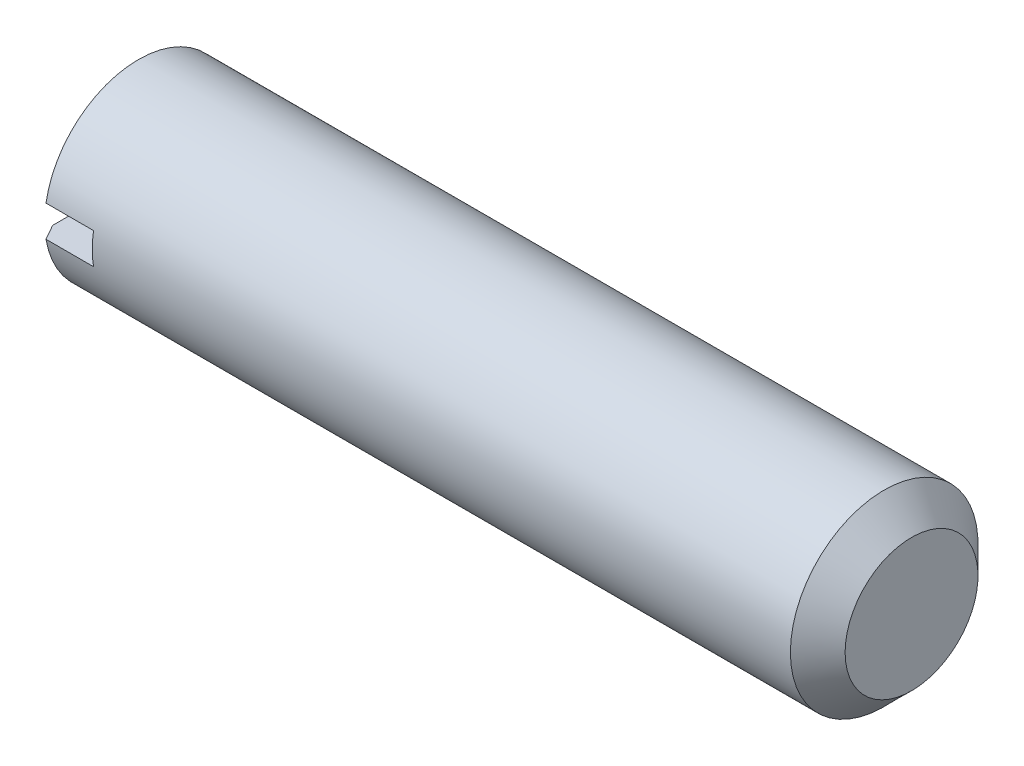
SolidWorks part; units mm, degrees
ref_plane "Plane1" through (0, 0, 0) normal (0, 0, 1) x (1, 0, 0)
ref_plane "Plane2" through (0, 0, 0) normal (0, 1, 0) x (1, 0, 0)
ref_plane "Plane3" through (0, 0, 0) normal (1, 0, 0) x (0, 0, -1)
sketch "BodySke" plane through (0, 0, 0) normal (0, 0, 1) x (1, 0, 0)
  line L0 (0.5566, -6) -> (47.1574, -6) construction
  line L1 (50, 0) -> (50, 4.25)
  line L2 (0.5566, 6) -> (48.25, 6)
  line L3 (50, 4.25) -> (48.25, 6)
  line L4 (50, 0) -> (0, 0)
  line L5 (-12.7, 0) -> (88.9, 0) construction
  line L6 (50, 4.25) -> (50, 19.05) construction
  line L7 (50, -4.25) -> (48.25, -6) construction
  line L8 (1.75, 12.7) -> (1.75, -3.175) construction
  line L9 (0, 0) -> (0, 5.036)
  line L10 (0, 5.036) -> (0.5566, 6)
  line L11 (0, -5.036) -> (0.5566, -6) construction
  dimension "Length" = 50
  dimension "Diameter" = 12
  dimension "Drive_ch_ang" = 60
  dimension "Cup_dia" = 8.5
  dimension "Nose_ch_ang" = 45
  dimension "Advance" = 1.75
  dimension "Minor_dia" = 10.072
revolve "BaseBody" add sketch "BodySke"
extrude "Slot" cut sketch "Sketch2" along normal blind 3.6
sketch "Sketch2" plane through (0, 0, 0) normal (1, 0, 0) x (0, 0, -1)
  line L1 (6, -1) -> (-6, -1)
  line L2 (6, -1) -> (6, 1)
  line L3 (6, 1) -> (-6, 1)
  line L4 (-6, -1) -> (-6, 1)
  dimension "D1" = 12
  dimension "D2" = 1
  dimension "Slot_width" = 2
  dimension "D3" = 6
sketch "ThdSchSke" plane through (0, 0, 0) normal (0, 0, 1) x (1, 0, 0)
  line L0 (0.5566, -5.036) -> (-0.1184, -6)
  line L1 (0.5566, -5.036) -> (1.2316, -6)
  line L2 (1.2316, -6) -> (1.2316, -7.5)
  line L3 (-3.175, 0) -> (5.1513, 0) construction
  line L5 (1.2316, -7.5) -> (-0.1184, -7.5)
  line L6 (-0.1184, -7.5) -> (-0.1184, -6)
  line L7 (0.5566, -6) -> (0.5566, -1) construction
  dimension "Thread_minor" = 10.072
  dimension "Diameter" = 12
  dimension "SideAngle" = 55
  dimension "VeeAngle" = 70
  dimension "Overcut" = 15
revolve "ThreadSchematic" [suppressed] cut sketch "ThdSchSke" angle 360 about L3
pattern_linear "ThdSchPat" [suppressed]
equation "\"D1@Sketch2\" = \"Diameter@BodySke\""
equation "\"D3@Sketch2\" = \"D1@Sketch2\" / 2"
equation "\"D2@Sketch2\" = \"Slot_width@Sketch2\" / 2"
equation "\"Thread_minor@ThdSchSke\" = \"Minor_dia@BodySke\""
equation "\"Diameter@ThdSchSke\" = \"Diameter@BodySke\""
equation "\"Overcut@ThdSchSke\" = \"Diameter@BodySke\" * 1.25"
equation "\"Num_threads@ThdSchPat\" = int( (\"Length@BodySke\" - ( ( ( \"Diameter@BodySke\" - \"Minor_dia@BodySke\" ) * 0.5 ) / tan( \"Drive_ch_ang@BodySke\" * 0.017453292 ) ) - ( ( ( \"Diameter@BodySke\" - \"Cup_dia@BodySk"
equation "\"Advance@ThdSchPat\" = (\"Length@BodySke\" - ( ( ( \"Diameter@BodySke\" - \"Minor_dia@BodySke\" ) * 0.5 ) / tan( \"Drive_ch_ang@BodySke\" * 0.017453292 ) ) - ( ( ( \"Diameter@BodySke\" - \"Cup_dia@BodySke\" ) * 0."
equation "' \"Num_threads@ThdSchPat\" = \"Num_threads@ThdSchPat\" - sgn( \"Num_threads@ThdSchPat\" - 1) '---chamfered tips only---"
